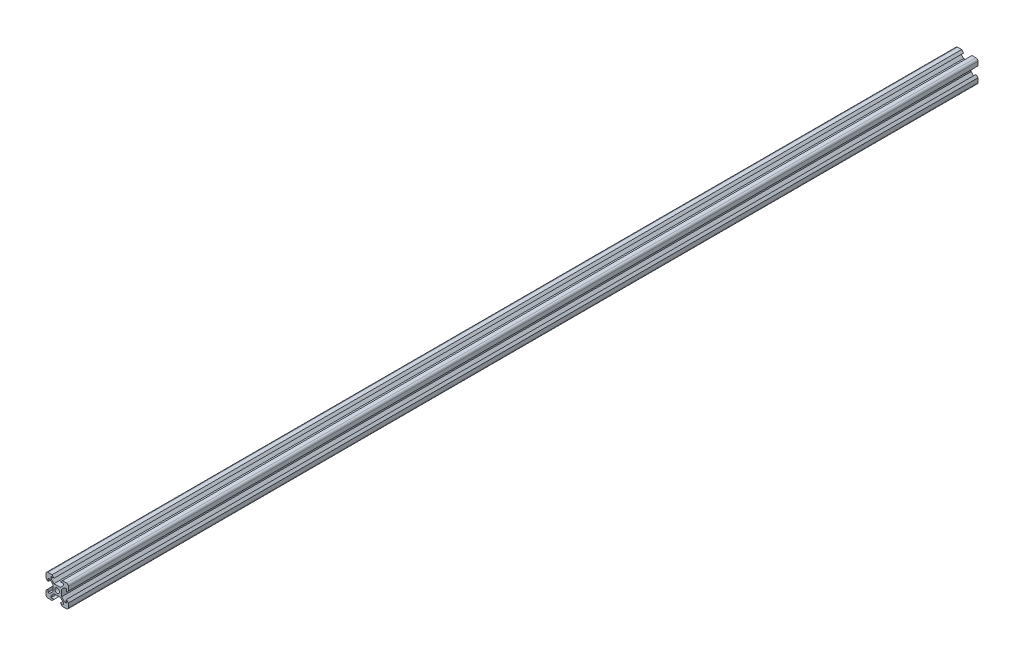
SolidWorks part; units mm, degrees
ref_plane "Front Plane" through (0, 0, 0) normal (0, 0, 1) x (1, 0, 0)
ref_plane "Top Plane" through (0, 0, 0) normal (0, 1, 0) x (1, 0, 0)
ref_plane "Right Plane" through (0, 0, 0) normal (1, 0, 0) x (0, 0, -1)
imported_body "Imported1"
sketch "Sketch1" plane through (0, 0, 25.4) normal (0, 0, 1) x (1, 0, 0)
  line L44 (-5.4993, -8.2) -> (-5.4993, -6.56)
  line L45 (-5.4993, -6.56) -> (-2.84, -3.9007)
  line L46 (-2.84, -3.9007) -> (2.84, -3.9007)
  line L47 (2.84, -3.9007) -> (5.4993, -6.56)
  line L48 (5.4993, -6.56) -> (5.4993, -8.2)
  line L49 (5.4993, -8.2) -> (2.7951, -8.2)
  line L50 (2.7951, -8.2) -> (4.5951, -10)
  line L51 (4.5951, -10) -> (8.2, -10)
  line L52 (10, -8.2) -> (10, -4.5951)
  line L53 (10, -4.5951) -> (8.2, -2.7951)
  line L54 (8.2, -2.7951) -> (8.2, -5.4993)
  line L55 (8.2, -5.4993) -> (6.56, -5.4993)
  line L56 (6.56, -5.4993) -> (3.9007, -2.84)
  line L57 (3.9007, -2.84) -> (3.9007, 2.84)
  line L58 (3.9007, 2.84) -> (6.56, 5.4993)
  line L59 (6.56, 5.4993) -> (8.2, 5.4993)
  line L60 (8.2, 5.4993) -> (8.2, 2.7951)
  line L61 (8.2, 2.7951) -> (10, 4.5951)
  line L62 (10, 4.5951) -> (10, 8.2)
  line L63 (8.2, 10) -> (4.5951, 10)
  line L64 (4.5951, 10) -> (2.7951, 8.2)
  line L65 (2.7951, 8.2) -> (5.4993, 8.2)
  line L66 (5.4993, 8.2) -> (5.4993, 6.56)
  line L67 (5.4993, 6.56) -> (2.84, 3.9007)
  line L68 (2.84, 3.9007) -> (-2.84, 3.9007)
  line L69 (-2.84, 3.9007) -> (-5.4993, 6.56)
  line L70 (-5.4993, 6.56) -> (-5.4993, 8.2)
  line L71 (-5.4993, 8.2) -> (-2.7951, 8.2)
  line L72 (-2.7951, 8.2) -> (-4.5951, 10)
  line L73 (-4.5951, 10) -> (-8.2, 10)
  line L74 (-10, 8.2) -> (-10, 4.5951)
  line L75 (-10, 4.5951) -> (-8.2, 2.7951)
  line L76 (-8.2, 2.7951) -> (-8.2, 5.4993)
  line L77 (-8.2, 5.4993) -> (-6.56, 5.4993)
  line L78 (-6.56, 5.4993) -> (-3.9007, 2.84)
  line L79 (-3.9007, 2.84) -> (-3.9007, -2.84)
  line L80 (-3.9007, -2.84) -> (-6.56, -5.4993)
  line L81 (-6.56, -5.4993) -> (-8.2, -5.4993)
  line L82 (-8.2, -5.4993) -> (-8.2, -2.7951)
  line L83 (-8.2, -2.7951) -> (-10, -4.5951)
  line L84 (-10, -4.5951) -> (-10, -8.2)
  line L85 (-8.2, -10) -> (-4.5951, -10)
  line L86 (-4.5951, -10) -> (-2.7951, -8.2)
  line L87 (-2.7951, -8.2) -> (-5.4993, -8.2)
  line L88 (-5.4993, -8.2) -> (-5.4993, -6.56)
  line L89 (-5.4993, -6.56) -> (-2.84, -3.9007)
  line L90 (-2.84, -3.9007) -> (2.84, -3.9007)
  line L91 (2.84, -3.9007) -> (5.4993, -6.56)
  line L92 (5.4993, -6.56) -> (5.4993, -8.2)
  line L93 (5.4993, -8.2) -> (2.7951, -8.2)
  line L94 (2.7951, -8.2) -> (4.5951, -10)
  line L95 (4.5951, -10) -> (8.2, -10)
  line L96 (10, -8.2) -> (10, -4.5951)
  line L97 (10, -4.5951) -> (8.2, -2.7951)
  line L98 (8.2, -2.7951) -> (8.2, -5.4993)
  line L99 (8.2, -5.4993) -> (6.56, -5.4993)
  line L100 (6.56, -5.4993) -> (3.9007, -2.84)
  line L101 (3.9007, -2.84) -> (3.9007, 2.84)
  line L102 (3.9007, 2.84) -> (6.56, 5.4993)
  line L103 (6.56, 5.4993) -> (8.2, 5.4993)
  line L104 (8.2, 5.4993) -> (8.2, 2.7951)
  line L105 (8.2, 2.7951) -> (10, 4.5951)
  line L106 (10, 4.5951) -> (10, 8.2)
  line L107 (8.2, 10) -> (4.5951, 10)
  line L108 (4.5951, 10) -> (2.7951, 8.2)
  line L109 (2.7951, 8.2) -> (5.4993, 8.2)
  line L110 (5.4993, 8.2) -> (5.4993, 6.56)
  line L111 (5.4993, 6.56) -> (2.84, 3.9007)
  line L112 (2.84, 3.9007) -> (-2.84, 3.9007)
  line L113 (-2.84, 3.9007) -> (-5.4993, 6.56)
  line L114 (-5.4993, 6.56) -> (-5.4993, 8.2)
  line L115 (-5.4993, 8.2) -> (-2.7951, 8.2)
  line L116 (-2.7951, 8.2) -> (-4.5951, 10)
  line L117 (-4.5951, 10) -> (-8.2, 10)
  line L118 (-10, 8.2) -> (-10, 4.5951)
  line L119 (-10, 4.5951) -> (-8.2, 2.7951)
  line L120 (-8.2, 2.7951) -> (-8.2, 5.4993)
  line L121 (-8.2, 5.4993) -> (-6.56, 5.4993)
  line L122 (-6.56, 5.4993) -> (-3.9007, 2.84)
  line L123 (-3.9007, 2.84) -> (-3.9007, -2.84)
  line L124 (-3.9007, -2.84) -> (-6.56, -5.4993)
  line L125 (-6.56, -5.4993) -> (-8.2, -5.4993)
  line L126 (-8.2, -5.4993) -> (-8.2, -2.7951)
  line L127 (-8.2, -2.7951) -> (-10, -4.5951)
  line L128 (-10, -4.5951) -> (-10, -8.2)
  line L129 (-8.2, -10) -> (-4.5951, -10)
  line L130 (-4.5951, -10) -> (-2.7951, -8.2)
  line L131 (-2.7951, -8.2) -> (-5.4993, -8.2)
  circle A0 centre (0, 0) radius 2.1 construction
  circle A1 centre (0, 0) radius 2.1
  arc A4 (8.2, -10) -> (10, -8.2) centre (8.2, -8.2) ccw
  arc A5 (10, 8.2) -> (8.2, 10) centre (8.2, 8.2) ccw
  arc A6 (-8.2, 10) -> (-10, 8.2) centre (-8.2, 8.2) ccw
  arc A7 (-10, -8.2) -> (-8.2, -10) centre (-8.2, -8.2) ccw
  arc A8 (8.2, -10) -> (10, -8.2) centre (8.2, -8.2) ccw
  arc A9 (10, 8.2) -> (8.2, 10) centre (8.2, 8.2) ccw
  arc A10 (-8.2, 10) -> (-10, 8.2) centre (-8.2, 8.2) ccw
  arc A11 (-10, -8.2) -> (-8.2, -10) centre (-8.2, -8.2) ccw
  dimension "D1" = 0
extrude "Boss-Extrude1" add sketch "Sketch1" along normal blind 787.4
